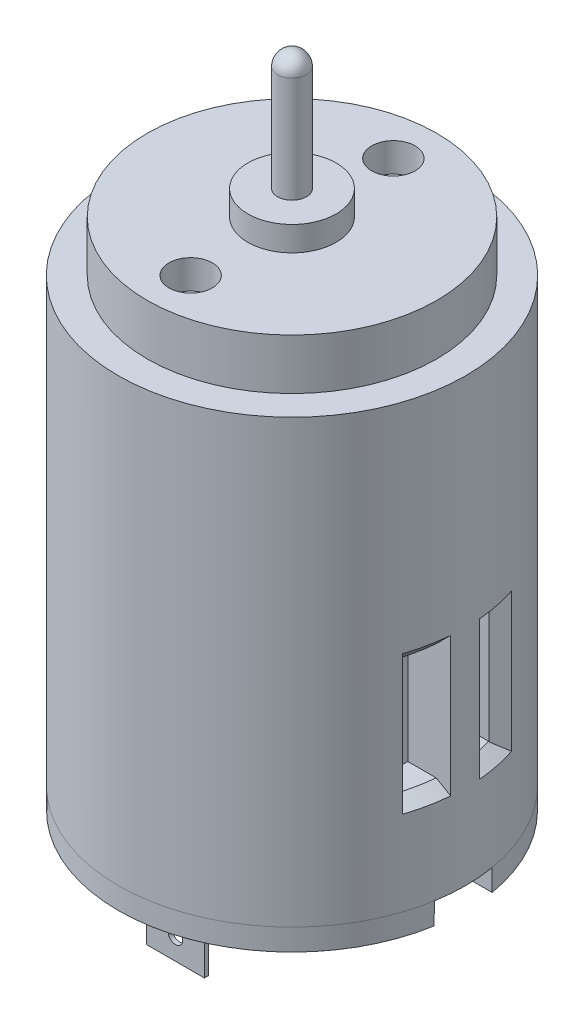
SolidWorks part; units mm, degrees
ref_plane "Front" through (0, 0, 0) normal (0, 0, 1) x (1, 0, 0)
ref_plane "Top" through (0, 0, 0) normal (0, 1, 0) x (1, 0, 0)
ref_plane "Right" through (0, 0, 0) normal (1, 0, 0) x (0, 0, -1)
sketch "Sketch1" plane through (0, 0, 0) normal (0, 1, 0) x (1, 0, 0)
  circle A0 centre (0, 0) radius 11.99
extrude "Extrude1" add sketch "Sketch1" along normal blind 1.5
sketch "Sketch2" plane through (0, 1.5, 0) normal (0, 1, 0) x (-1, 0, 0)
  circle A0 centre (0, 0) radius 12
extrude "Extrude2" add sketch "Sketch2" along normal blind 30.5
sketch "Sketch3" plane through (0, 32, 0) normal (0, 1, 0) x (-1, 0, 0)
  circle A0 centre (0, 0) radius 10
extrude "Extrude3" add sketch "Sketch3" along normal blind 3.5
sketch "Sketch4" plane through (0, 35.5, 0) normal (0, 1, 0) x (-1, 0, 0)
  circle A0 centre (0, 0) radius 3.05
extrude "Extrude4" add sketch "Sketch4" along normal blind 1.7
sketch "Sketch5" plane through (0, 37.2, 0) normal (0, 1, 0) x (-1, 0, 0)
  circle A0 centre (0, 0) radius 1
extrude "Extrude5" add sketch "Sketch5" along normal blind 8.3
sketch "Sketch6" plane through (0, 0, 0) normal (0, -1, 0) x (1, 0, 0)
  circle A0 centre (0, 0) radius 3.1
extrude "Extrude6" add sketch "Sketch6" along normal blind 3
sketch "Sketch7" plane through (0, -3, 0) normal (0, -1, 0) x (1, 0, 0)
  circle A0 centre (0, 0) radius 1.25
extrude "Cut-Extrude1" cut sketch "Sketch7" against normal blind 3
sketch "Sketch8" plane through (0, 0, 0) normal (0, -1, 0) x (1, 0, 0)
  circle A0 centre (0, 0) radius 1
extrude "Extrude7" add sketch "Sketch8" along normal blind 3
fillet "Fillet1" radius 1 1 edges at (0, -3, -1)
fillet "Fillet2" radius 1 1 edges at (0, 45.5, 1)
chamfer "Chamfer1" distance 1 1 edges at (0, -3, -3.1)
sketch "Sketch9" plane through (0, 35.5, 0) normal (0, 1, 0) x (-1, 0, 0)
  line L0 (5.4222, 0) -> (-6.7708, 0) construction
  circle A1 centre (0, 7) radius 1.5
  circle A2 centre (0, -7) radius 1.5
  dimension "D1" = 7
  dimension "D2" = 7
extrude "Cut-Extrude2" cut sketch "Sketch9" against normal blind 2
sketch "Sketch10" plane through (0, 0, 0) normal (0, -1, 0) x (1, 0, 0)
  line L0 (0, 8.05) -> (5.1913, 8.05) construction
  line L1 (0, 7.75) -> (2, 7.75)
  line L2 (0, 7.75) -> (-2, 7.75)
  line L3 (0, -7.75) -> (2, -7.75)
  line L4 (0, -7.75) -> (-2, -7.75)
  line L5 (0, 8.05) -> (2, 8.05)
  line L6 (0, 8.05) -> (-2, 8.05)
  line L7 (0, -8.05) -> (-2, -8.05)
  line L8 (0, -8.05) -> (2, -8.05)
  line L9 (-2, 8.05) -> (-2, 7.75)
  line L10 (2, 8.05) -> (2, 7.75)
  line L11 (0, 7.75) -> (5.1913, 7.75) construction
  line L12 (0, -7.75) -> (6.3555, -7.75) construction
  line L13 (0, -8.05) -> (6.3555, -8.05) construction
  line L14 (0, -8.05) -> (-6.074, -8.05) construction
  line L15 (0, -7.75) -> (-6.074, -7.75) construction
  line L16 (-2, -7.75) -> (-2, -8.05)
  line L17 (2, -7.75) -> (2, -8.05)
  line L18 (0, 8.05) -> (-5.5563, 8.05) construction
  line L19 (0, 7.75) -> (-5.5563, 7.75) construction
extrude "Extrude8" add sketch "Sketch10" along normal blind 5
sketch "Sketch11" plane through (0, 0, -8.05) normal (0, 0, -1) x (-1, 0, 0)
  line L5 (-0.5, -1.5) -> (-0.5, -3.5)
  line L6 (0.5, -3.5) -> (0.5, -1.5)
  arc A0 (0.5, -1.5) -> (-0.5, -1.5) centre (0, -1.5) ccw
  arc A1 (-0.5, -3.5) -> (0.5, -3.5) centre (0, -3.5) ccw
extrude "Cut-Extrude3" cut sketch "Sketch11" against normal blind 1
sketch "Sketch12" plane through (0, 0, 8.05) normal (0, 0, 1) x (1, 0, 0)
  line L0 (-0.5, -3.5) -> (-0.5, -1.5)
  line L3 (0.5, -1.5) -> (0.5, -3.5)
  arc A0 (-0.5, -3.5) -> (0.5, -3.5) centre (0, -3.5) ccw
  arc A1 (0.5, -1.5) -> (-0.5, -1.5) centre (0, -1.5) ccw
extrude "Cut-Extrude4" cut sketch "Sketch12" against normal blind 1
sketch "Sketch13" plane through (0, 0, 0) normal (1, 0, 0) x (0, 0, -1)
  line L0 (-3, 15.9442) -> (-1, 15.9442)
  line L1 (3, 7.9232) -> (1, 7.9232)
  line L2 (-3, 25) -> (-3, 0) construction
  line L4 (-1, 15.9442) -> (-1, 7.9232)
  line L5 (1, 15.9442) -> (1, 7.9232)
  line L6 (-3, 15.9442) -> (-3, 7.9232)
  line L7 (3, 15.9442) -> (3, 7.9232)
  line L8 (-1, 25) -> (-1, 0) construction
  line L9 (1, 25) -> (1, 0) construction
  line L10 (3, 25) -> (3, 0) construction
  line L11 (1, 15.9442) -> (3, 15.9442)
  line L12 (-1, 7.9232) -> (-3, 7.9232)
extrude "Cut-Extrude5" cut sketch "Sketch13" against normal mid plane 31
sketch "Sketch14" plane through (0, 0, 0) normal (1, 0, 0) x (0, 0, -1)
  line L1 (-4.525, 17.244) -> (4.7696, 17.244)
  line L2 (-4.525, 17.244) -> (-4.525, 6.7264)
  line L3 (-4.525, 6.7264) -> (4.7696, 6.7264)
  line L4 (4.7696, 17.244) -> (4.7696, 6.7264)
extrude "Extrude9" add sketch "Sketch14" along normal mid plane 18
chamfer "Chamfer2" distance 1 angle 45 2 edges at (11.8309, 15.9442, 2.0072) (11.8309, 15.9442, -2.0072)
chamfer "Chamfer3" distance 1 angle 45 2 edges at (-11.8309, 15.9442, -2.0072) (-11.8309, 15.9442, 2.0072)
chamfer "Chamfer4" distance 1 angle 30 2 edges at (-11.8309, 7.9232, -2.0072) (-11.8309, 7.9232, 2.0072)
chamfer "Chamfer5" distance 1 angle 30 2 edges at (11.8309, 7.9232, 2.0072) (11.8309, 7.9232, -2.0072)
chamfer "Chamfer6" distance 1 angle 45 2 edges at (11.619, 12.145, 3) (11.619, 12.145, -3)
chamfer "Chamfer7" distance 1 angle 45 2 edges at (-11.619, 12.145, -3) (-11.619, 12.145, 3)
sketch "Sketch15" plane through (0, 0, 0) normal (0, -1, 0) x (1, 0, 0)
  line L1 (-8.01, 2) -> (-17.5837, 2)
  line L2 (-8.01, -2) -> (-19.2932, -2)
  line L3 (8.01, 2) -> (16.9737, 2)
  line L4 (8.01, -2) -> (18.3307, -2)
  line L5 (18.3307, -2) -> (16.9737, 2)
  line L6 (-19.2932, -2) -> (-17.5837, 2)
  arc A3 (-8.01, -2) -> (-8.01, 2) centre (-8.01, 0) ccw
  arc A4 (8.01, 2) -> (8.01, -2) centre (8.01, 0) ccw
extrude "Cut-Extrude6" cut sketch "Sketch15" against normal blind 1.5
